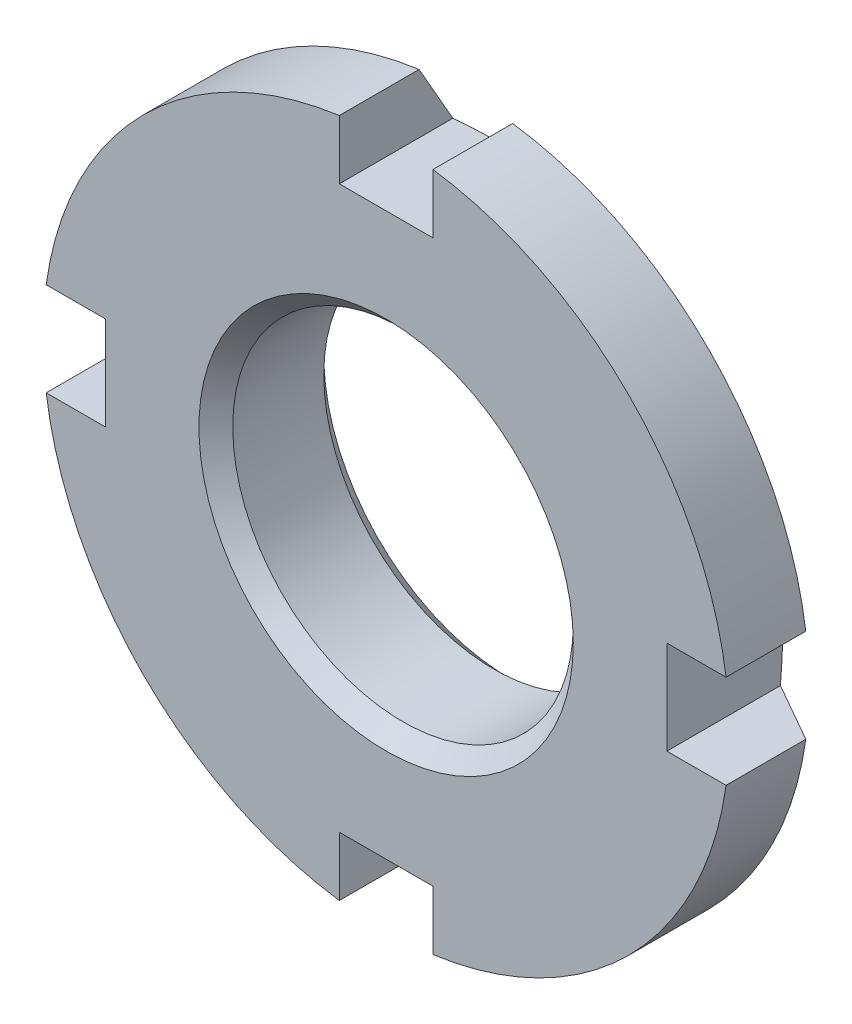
SolidWorks part; units mm, degrees
ref_plane "Front X-Y" through (0, 0, 0) normal (0, 0, 1) x (1, 0, 0)
ref_plane "Top X-Z" through (0, 0, 0) normal (0, 1, 0) x (1, 0, 0)
ref_plane "Right Y-Z" through (0, 0, 0) normal (1, 0, 0) x (0, 0, -1)
ref_plane "Plane1" through (0, 0, 0) normal (1, 0, 0) x (0, 0, -1)
sketch "Sketch1" plane through (0, 0, 0) normal (1, 0, 0) x (0, 0, -1)
  line L0 (0, 11) -> (0, 6)
  line L1 (0, 6) -> (0.5415, 5.4585)
  line L2 (0.5415, 5.4585) -> (3.4585, 5.4585)
  line L3 (3.4585, 5.4585) -> (4, 6)
  line L4 (4, 6) -> (4, 8.5)
  line L5 (4, 8.5) -> (2.5566, 11)
  line L6 (2.5566, 11) -> (0, 11)
  line L7 (4, 0) -> (0, 0) construction
revolve "Revolve1" add sketch "Sketch1" angle 360 about L7
ref_plane "Plane2" through (0, 0, 0) normal (0, 0, 1) x (1, 0, 0)
sketch "Sketch2" plane through (0, 0, 0) normal (0, 0, 1) x (1, 0, 0)
  line L0 (-16.8565, 1.5) -> (-9, 1.5)
  line L1 (-9, 1.5) -> (-9, -1.5)
  line L2 (-9, -1.5) -> (-16.8565, -1.5)
  line L3 (-1.5, -16.8565) -> (-1.5, -9)
  line L4 (-1.5, -9) -> (1.5, -9)
  line L5 (1.5, -9) -> (1.5, -16.8565)
  line L6 (16.8565, -1.5) -> (9, -1.5)
  line L7 (9, -1.5) -> (9, 1.5)
  line L8 (9, 1.5) -> (16.8565, 1.5)
  line L9 (1.5, 16.8565) -> (1.5, 9)
  line L10 (1.5, 9) -> (-1.5, 9)
  line L11 (-1.5, 9) -> (-1.5, 16.8565)
  circle A0 centre (0, 0) radius 22
  arc A1 (-16.8565, -1.5) -> (-1.5, -16.8565) centre (0, 0) ccw
  arc A2 (1.5, -16.8565) -> (16.8565, -1.5) centre (0, 0) ccw
  arc A3 (16.8565, 1.5) -> (1.5, 16.8565) centre (0, 0) ccw
  arc A4 (-1.5, 16.8565) -> (-16.8565, 1.5) centre (0, 0) ccw
extrude "Cut-Extrude1" cut sketch "Sketch2" against normal blind 4
